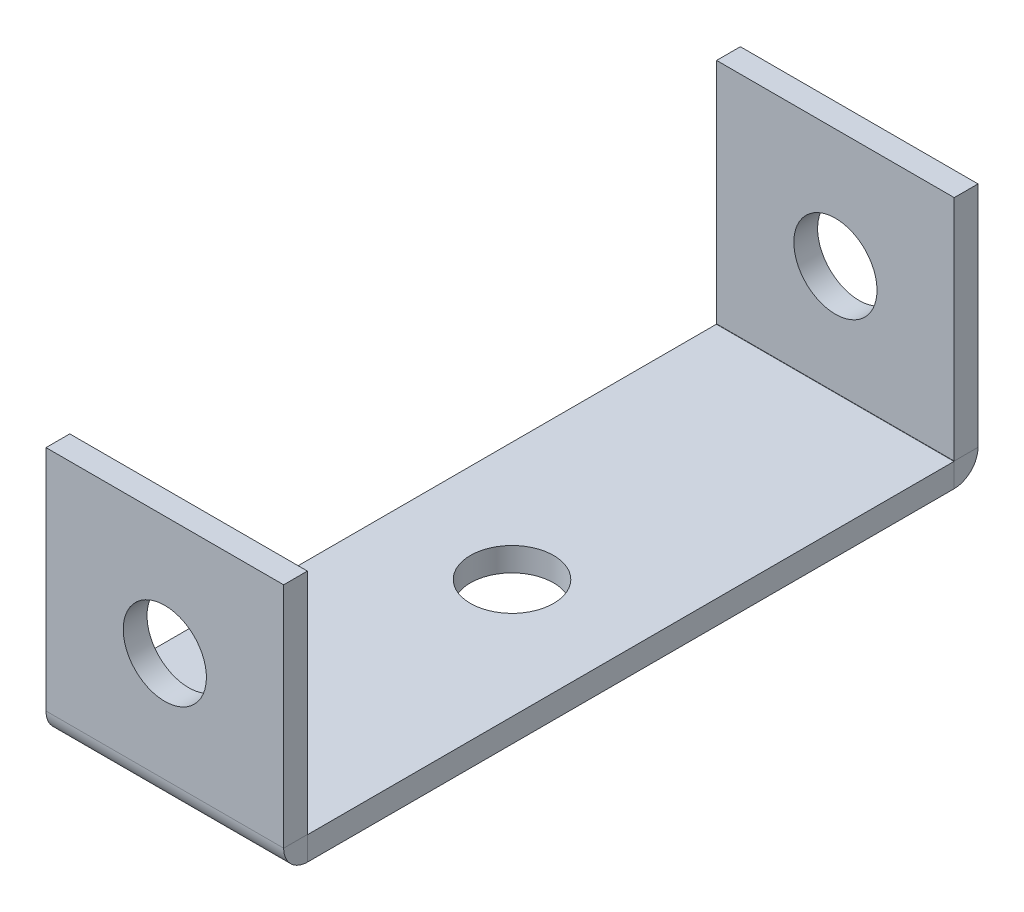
SolidWorks part; units mm, degrees
ref_plane "Front" through (0, 0, 0) normal (0, 0, 1) x (1, 0, 0)
ref_plane "Top" through (0, 0, 0) normal (0, 1, 0) x (1, 0, 0)
ref_plane "Right" through (0, 0, 0) normal (1, 0, 0) x (0, 0, -1)
sketch "Sketch1" plane through (0, 0, 0) normal (0, 1, 0) x (1, 0, 0)
  line L1 (0, 0) -> (10, 0)
  line L2 (0, 0) -> (0, 48)
  line L3 (0, 48) -> (10, 48)
  line L4 (10, 0) -> (10, 48)
  circle A0 centre (5, 43) radius 1.75
  circle A1 centre (5, 24) radius 1.75
  circle A2 centre (5, 5) radius 1.75
sheet metal parameters "Sheet-Metal1" thickness 1 parameters "D1"=0.01
base flange "Base-Flange1" sketch "Sketch1" thickness 1 reverse thickness direction yes parameters "D1"=0.01
sketch "Sketch3" plane through (0, 1, 0) normal (0, 1, 0) x (-1, 0, 0)
  line L0 (0, -10) -> (-10, -10)
  line L1 (0, -48) -> (0, 0) construction
  line L2 (-10, 0) -> (-10, -48) construction
  line L3 (0, -38) -> (-10, -38)
sketched bend "Sketched Bend1" parameters "D1"=0
bend "SketchBend1" bend radius 0.01 bend angle 90 parameters "D5"=1
bend "SketchBend2" bend radius 0 bend angle 90 parameters "D5"=2
flat pattern "Flat-Pattern1"
sketch "Bend-Lines1" plane through (0, 1, 0) normal (0, 1, 0) x (-1, 0, 0)
  line L0 (0, -38) -> (-10, -38) construction
  line L1 (0, -10) -> (-10, -10) construction
bend of the flat pattern "Flatten-<SketchBend1>1"
bend of the flat pattern "Flatten-<SketchBend2>1"
